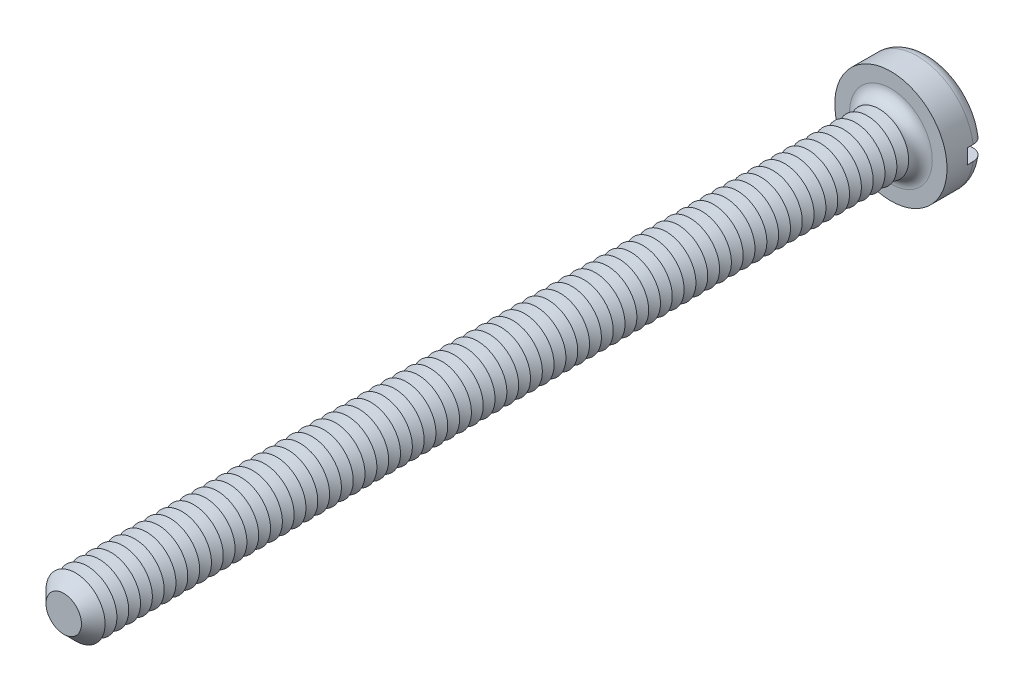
SolidWorks part; units mm, degrees
ref_plane "Front Plane" through (0, 0, 0) normal (0, 0, 1) x (1, 0, 0)
ref_plane "Top Plane" through (0, 0, 0) normal (0, 1, 0) x (1, 0, 0)
ref_plane "Right Plane" through (0, 0, 0) normal (1, 0, 0) x (0, 0, -1)
sketch "Sketch3" plane through (0, 0, 0) normal (0, 0, 1) x (1, 0, 0)
  circle A0 centre (0, 0) radius 1.9
  dimension "D1" = 3.8
extrude "Boss-Extrude2" add sketch "Sketch3" against normal blind 1.3
sketch "Sketch4" plane through (0, 0, 0) normal (0, 0, 1) x (1, 0, 0)
  circle A0 centre (0, 0) radius 1
  dimension "D1" = 2
extrude "Boss-Extrude3" add sketch "Sketch4" along normal blind 28
fillet "Fillet1" radius 0.4 2 edges at (1.9, 0, -1.3) (1, 0, 0)
chamfer "Chamfer1" distance 0.4 angle 45 1 edges at (1, 0, 28)
sketch "Sketch5" plane through (0, 0, 0) normal (1, 0, 0) x (0, 0, -1)
  line L0 (1.6944, 0) -> (-7.6738, 0) construction
sketch "Sketch6" plane through (0, 0, 0) normal (1, 0, 0) x (0, 0, -1)
  line L0 (-0.4, 1) -> (-0.6, 0.6536)
  line L1 (-0.6, 0.6536) -> (-0.8, 1)
  line L2 (-0.4, 1) -> (-27.6, 1) construction
  line L3 (-0.8, 1) -> (-0.4, 1)
  dimension "D1" = 0.4
revolve "Cut-Revolve1" cut sketch "Sketch6" angle 360 about L0
pattern_linear "LPattern1" count 68 spacing 0.4 along (0, 0, 1) of "Cut-Revolve1"
sketch "Sketch8" plane through (0, 0, -1.3) normal (0, 0, -1) x (-1, 0, 0)
  line L1 (1.9, -0.25) -> (-1.9, -0.25)
  line L2 (1.9, -0.25) -> (1.9, 0.25)
  line L3 (1.9, 0.25) -> (-1.9, 0.25)
  line L4 (-1.9, -0.25) -> (-1.9, 0.25)
  line L5 (1.9, -0.25) -> (-1.9, 0.25) construction
  line L6 (1.9, 0.25) -> (-1.9, -0.25) construction
  point P0 (0, 0)
  dimension "D1" = 3.8
  dimension "D2" = 0.5
extrude "Cut-Extrude1" cut sketch "Sketch8" against normal blind 0.6
